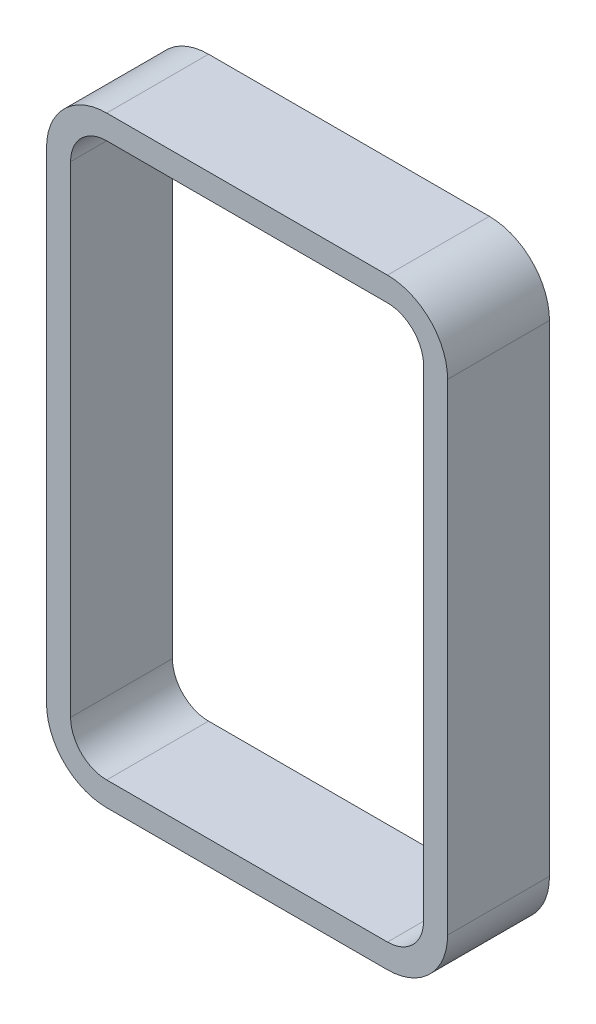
SolidWorks part; units mm, degrees
ref_plane "Front Plane" through (0, 0, 0) normal (0, 0, 1) x (1, 0, 0)
ref_plane "Top Plane" through (0, 0, 0) normal (0, 1, 0) x (1, 0, 0)
ref_plane "Right Plane" through (0, 0, 0) normal (1, 0, 0) x (0, 0, -1)
sketch "Sketch1" plane through (0, 0, 0) normal (0, 0, 1) x (1, 0, 0)
  line L0 (-35, 69) -> (35, 69)
  line L1 (-35, -75) -> (35, -75)
  line L2 (-50, -60) -> (-50, 60)
  line L3 (-35, 75) -> (35, 75)
  line L4 (50, -60) -> (50, 60)
  line L5 (-50, -75) -> (50, 75) construction
  line L6 (-50, 75) -> (50, -75) construction
  line L7 (44, -60) -> (44, 60)
  line L8 (-35, -69) -> (35, -69)
  line L9 (-44, -60) -> (-44, 60)
  arc A0 (-50, 60) -> (-35, 75) centre (-35, 60) cw
  arc A1 (35, 75) -> (50, 60) centre (35, 60) cw
  arc A2 (-35, -75) -> (-50, -60) centre (-35, -60) cw
  arc A3 (35, -75) -> (50, -60) centre (35, -60) ccw
  arc A4 (-44, 60) -> (-35, 69) centre (-35, 60) cw
  arc A5 (35, 69) -> (44, 60) centre (35, 60) cw
  arc A6 (35, -69) -> (44, -60) centre (35, -60) ccw
  arc A7 (-35, -69) -> (-44, -60) centre (-35, -60) cw
  point P0 (0, 0)
  dimension "D2" = 15
  dimension "Thickness" = 6
  dimension "Width" = 100
  dimension "Depth" = 150
extrude "BaseSection" add sketch "Sketch1" along normal mid plane 25.4
equation "\"D2@Sketch1\" = \"Thickness@Sketch1\" * (  (IIf(\"Thickness@Sketch1\">3, 1.5, 1))  + 1 ) "
